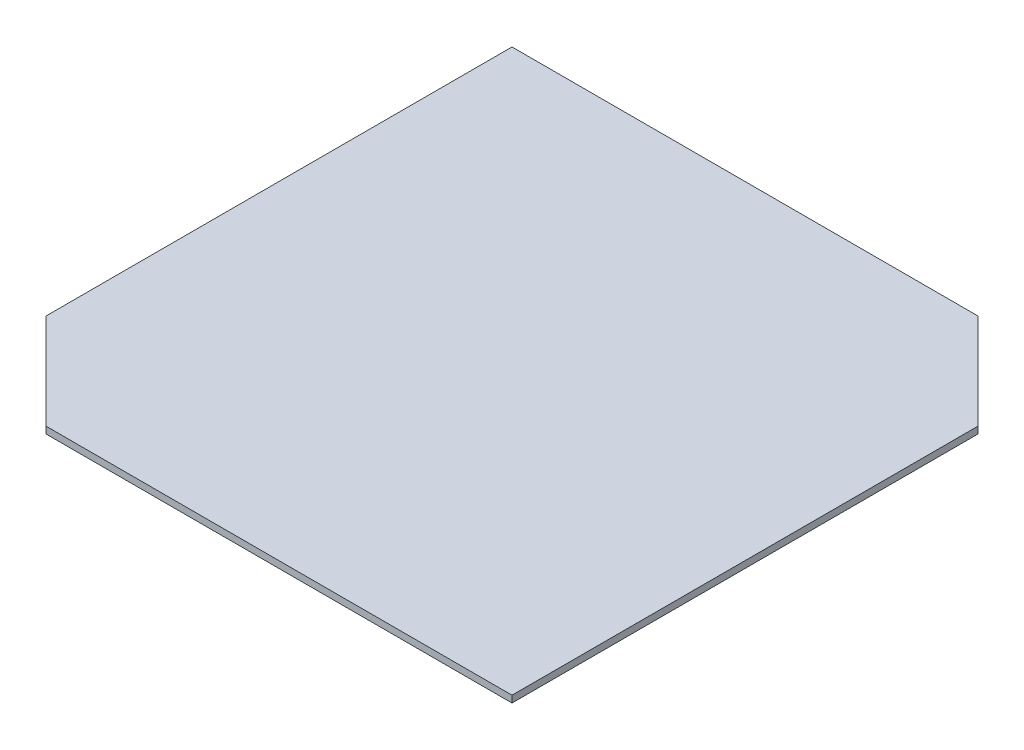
SolidWorks part; units mm, degrees
ref_plane "Front" through (0, 0, 0) normal (0, 0, 1) x (1, 0, 0)
ref_plane "Top" through (0, 0, 0) normal (0, 1, 0) x (1, 0, 0)
ref_plane "Right" through (0, 0, 0) normal (1, 0, 0) x (0, 0, -1)
sketch "Sketch1" plane through (0, 0, 0) normal (0, 1, 0) x (1, 0, 0)
  line L1 (206, -206) -> (-206, -206)
  line L2 (206, -206) -> (206, 206)
  line L3 (206, 206) -> (-206, 206)
  line L4 (-206, -206) -> (-206, 206)
  line L5 (206, -206) -> (-206, 206) construction
  line L6 (206, 206) -> (-206, -206) construction
  point P0 (0, 0)
  dimension "D1" = 412
extrude "Extrude1" add sketch "Sketch1" along normal blind 5
chamfer "Chamfer1" distance 70 angle 45 2 edges at (206, 2.5, -206) (-206, 2.5, 206)
